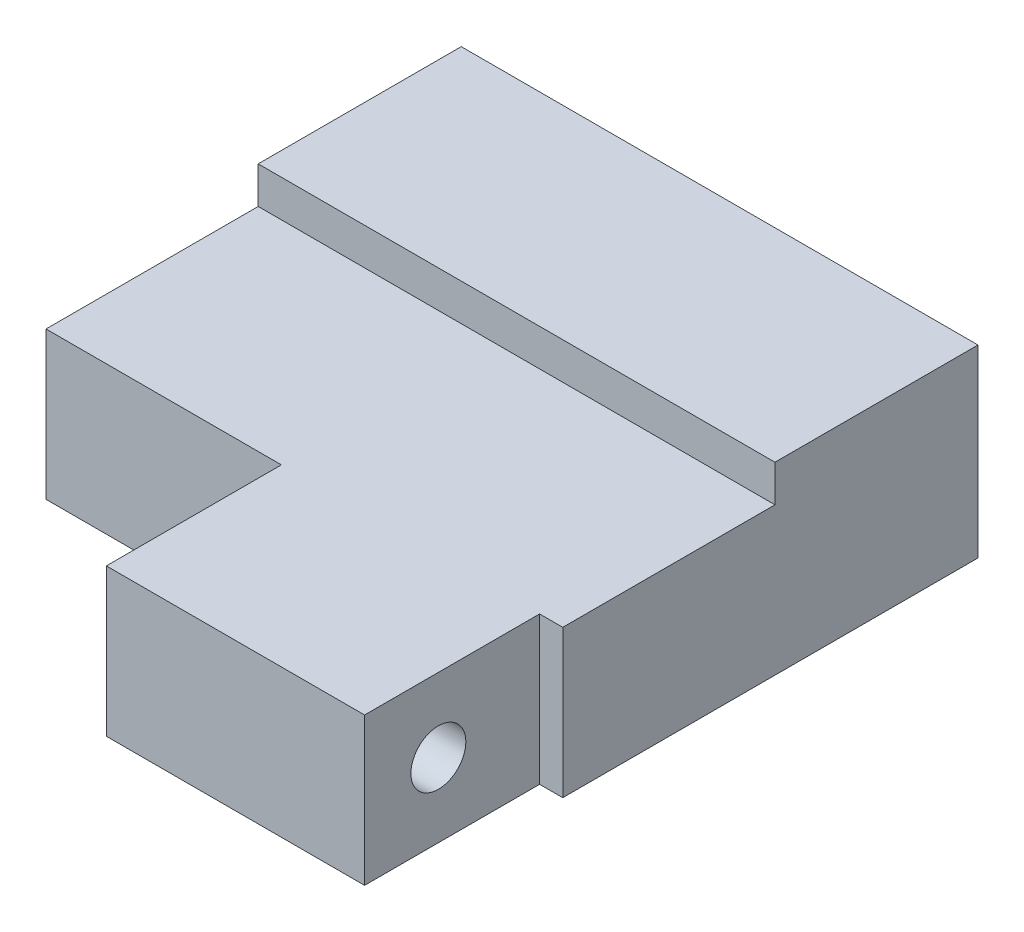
SolidWorks part; units mm, degrees
ref_plane "Front Plane" through (0, 0, 0) normal (0, 0, 1) x (1, 0, 0)
ref_plane "Top Plane" through (0, 0, 0) normal (0, 1, 0) x (1, 0, 0)
ref_plane "Right Plane" through (0, 0, 0) normal (1, 0, 0) x (0, 0, -1)
sketch "Sketch1" plane through (0, 0, 0) normal (0, 0, 1) x (1, 0, 0)
  line L0 (0, 0) -> (0, 28.9276) construction
  line L1 (-22.2377, -11.0998) -> (22.2377, -11.0998)
  line L2 (22.2377, -11.0998) -> (22.2377, 4.7752)
  line L3 (22.2377, 4.7752) -> (-22.2377, 4.7752)
  line L4 (-22.2377, 4.7752) -> (-22.2377, -11.0998)
  circle A0 centre (17.4625, 0) radius 2.3876
  circle A1 centre (-17.4625, 0) radius 2.3876
  dimension "D2" = 4.7752
  dimension "D1" = 34.925
  dimension "D3" = 4.7752
  dimension "D4" = 4.7752
  dimension "D5" = 4.7752
  dimension "D6" = 15.875
sketch "Sketch2" plane through (0, 0, 0) normal (0, 0, 1) x (1, 0, 0)
  line L0 (-22.2377, -11.0998) -> (22.2377, -11.0998) construction
  line L1 (22.2377, -11.0998) -> (22.2377, 4.7752) construction
  line L2 (22.2377, 4.7752) -> (-22.2377, 4.7752) construction
  line L3 (-22.2377, 4.7752) -> (-22.2377, -11.0998) construction
  line L4 (-22.2377, -11.0998) -> (22.2377, -11.0998)
  line L5 (22.2377, -11.0998) -> (22.2377, 4.7752)
  line L6 (22.2377, 4.7752) -> (-22.2377, 4.7752)
  line L7 (-22.2377, 4.7752) -> (-22.2377, -11.0998)
extrude "Boss-Extrude1" add sketch "Sketch2" along normal blind 50.8
sketch "Sketch3" plane through (0, 0, 0) normal (0, 1, 0) x (1, 0, 0)
  line L0 (22.2377, -35.7378) -> (20.2438, -35.7378)
  line L1 (22.2377, -50.8) -> (22.2377, 0) construction
  line L2 (20.2438, -35.7378) -> (20.2438, -50.8)
  line L3 (22.2377, -50.8) -> (-22.2377, -50.8) construction
  line L4 (20.2438, -50.8) -> (22.2377, -50.8)
  line L5 (22.2377, -50.8) -> (22.2377, -35.7378)
  line L6 (-1.9812, -50.8) -> (-1.9812, -35.7378)
  line L7 (-1.9812, -35.7378) -> (-22.2377, -35.7378)
  line L8 (-22.2377, -50.8) -> (-22.2377, 0) construction
  line L9 (-22.2377, -35.7378) -> (-22.2377, -50.8)
  line L10 (-22.2377, -50.8) -> (-1.9812, -50.8)
  dimension "D1" = 22.225
  dimension "D2" = 15.0622
  dimension "D3" = 20.2438
extrude "Cut-Extrude1" cut sketch "Sketch3" against normal mid plane 25.4
sketch "Sketch4" plane through (0, 0, 0) normal (1, 0, 0) x (0, 0, -1)
  line L1 (-50.8, -11.0998) -> (-50.8, 4.7752) construction
  line L2 (-35.7378, -11.0998) -> (-50.8, -11.0998) construction
  circle A0 centre (-44.45, -4.7498) radius 2.3652
  dimension "D1" = 6.35
  dimension "D2" = 6.35
extrude "Cut-Extrude2" cut sketch "Sketch4" against normal mid plane 50.8
sketch "Sketch5" plane through (0, 0, 0) normal (0, 0, -1) x (-1, 0, 0)
  circle A0 centre (-17.4625, 0) radius 2.3876 construction
  circle A1 centre (17.4625, 0) radius 2.3876 construction
  circle A2 centre (-17.4625, 0) radius 2.3876
  circle A3 centre (17.4625, 0) radius 2.3876
extrude "Cut-Extrude3" cut sketch "Sketch5" against normal blind 15.875
sketch "Sketch6" plane through (0, 0, 0) normal (1, 0, 0) x (0, 0, -1)
  line L0 (-17.4752, 4.7752) -> (-17.4752, 1.6002)
  line L1 (-35.7378, 4.7752) -> (0, 4.7752) construction
  line L2 (-17.4752, 1.6002) -> (-50.8, 1.6002)
  line L3 (-50.8, 4.7752) -> (-50.8, -11.0998) construction
  line L4 (-50.8, 1.6002) -> (-50.8, 4.7752)
  line L5 (-50.8, 4.7752) -> (-17.4752, 4.7752)
  dimension "D1" = 3.175
  dimension "D2" = 17.4752
extrude "Cut-Extrude5" cut sketch "Sketch6" along normal mid plane 76.2
